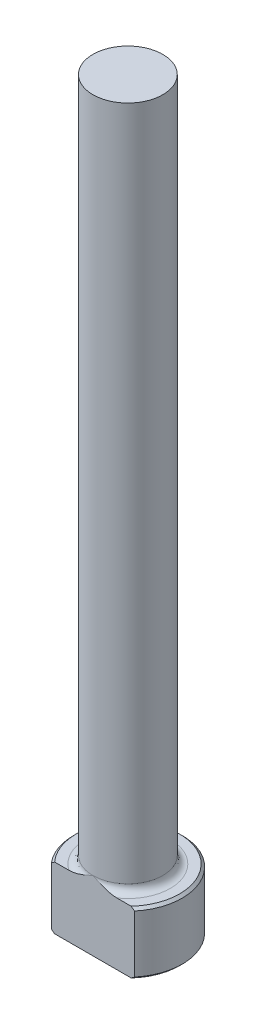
SolidWorks part; units mm, degrees
ref_plane "Front Plane" through (0, 0, 0) normal (0, 0, 1) x (1, 0, 0)
ref_plane "Top Plane" through (0, 0, 0) normal (0, 1, 0) x (1, 0, 0)
ref_plane "Right Plane" through (0, 0, 0) normal (1, 0, 0) x (0, 0, -1)
sketch "Sketch1" plane through (0, 0, 0) normal (0, 0, 1) x (1, 0, 0)
  line L0 (0, 259.9588) -> (0, -15.1925) construction
  line L1 (0, 0) -> (-5.5499, 0)
  line L2 (-5.5499, 0) -> (-5.5499, 6.35)
  line L3 (-5.5499, 6.35) -> (-3.5712, 6.35)
  line L4 (-3.5712, 6.35) -> (-3.5712, 76.2)
  line L5 (-3.5712, 76.2) -> (0, 76.2)
  line L6 (0, 76.2) -> (0, 0)
  dimension "L" = 76.2
  dimension "H" = 11.0998
  dimension "T" = 6.35
  dimension "D" = 7.1425
revolve "Revolve1" add sketch "Sketch1" angle 360 about L0
chamfer "Chamfer1" distance 0.254 angle 45 2 edges at (0, 6.35, 5.5499) (0, 0, 5.5499)
fillet "Fillet1" radius 0.762 1 edges at (0, 6.35, 3.5712)
sketch "Sketch2" plane through (0, 0, 0) normal (0, 1, 0) x (1, 0, 0)
  line L0 (-4.2483, -3.5712) -> (4.2483, -3.5712)
  circle A0 centre (0, 0) radius 5.5499 construction
  arc A1 (-4.2483, -3.5712) -> (4.2483, -3.5712) centre (0, 0) ccw
  circle A3 centre (0, 0) radius 3.5712 construction
  dimension "D1" = 0
extrude "Key" cut sketch "Sketch2" along normal through all
sketch "Pocket Sketch" plane through (0, 0, 0) normal (0, 0, 1) x (1, 0, 0)
  line L0 (-5.9468, 0) -> (-5.9468, 6.3754)
  line L1 (-5.9468, 6.3754) -> (-4.7301, 6.3754)
  line L2 (-3.9681, 7.1374) -> (-3.9681, 22.225)
  line L3 (-3.9681, 22.225) -> (0, 22.225)
  line L4 (0, 22.225) -> (0, 0)
  line L5 (0, 0) -> (-5.9468, 0)
  line L6 (0, 12.6104) -> (0, -2.4989) construction
  line L7 (-5.5499, 6.096) -> (-5.5499, 0.254) construction
  line L8 (5.2959, 6.35) -> (-5.2959, 6.35) construction
  line L9 (-3.5712, 76.2) -> (-3.5712, 7.112) construction
  line L10 (-4.7301, 6.3754) -> (-3.9681, 7.1374)
  point P3 (-3.9681, 6.3754)
  dimension "D1" = 11.8935
  dimension "D2" = 0.3969
  dimension "D3" = 0.0254
  dimension "D4" = 0.3969
  dimension "D5" = 7.9362
  dimension "D6" = 22.225
